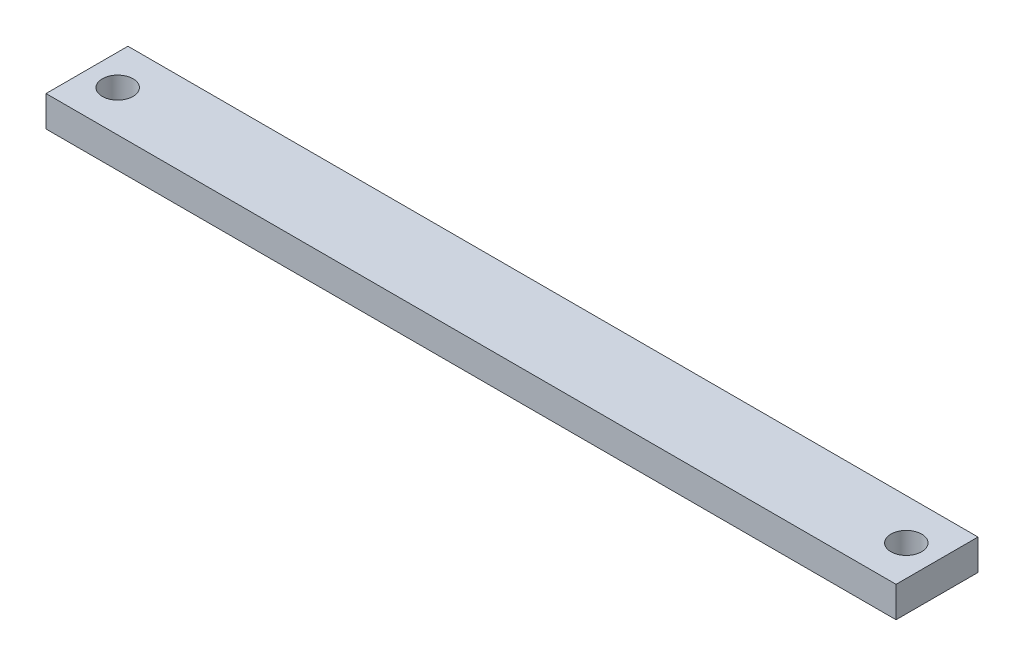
SolidWorks part; units mm, degrees
ref_plane "Plan de face" through (0, 0, 0) normal (0, 0, 1) x (1, 0, 0)
ref_plane "Plan de dessus" through (0, 0, 0) normal (0, 1, 0) x (1, 0, 0)
ref_plane "Plan de droite" through (0, 0, 0) normal (1, 0, 0) x (0, 0, -1)
sketch "Esquisse1" plane through (0, 0, 0) normal (0, 1, 0) x (1, 0, 0)
  line L1 (-48.0701, 8) -> (34.9299, 8)
  line L2 (-48.0701, 8) -> (-48.0701, 0)
  line L3 (-48.0701, 0) -> (34.9299, 0)
  line L4 (34.9299, 8) -> (34.9299, 0)
  circle A0 centre (-45.0701, 4) radius 1.5
  circle A1 centre (31.9299, 4) radius 1.5
  dimension "D3" = 3
  dimension "D1" = 8
  dimension "D2" = 83
  dimension "D4" = 3
  dimension "D5" = 4
extrude "Extrusion1" add sketch "Esquisse1" along normal blind 3
